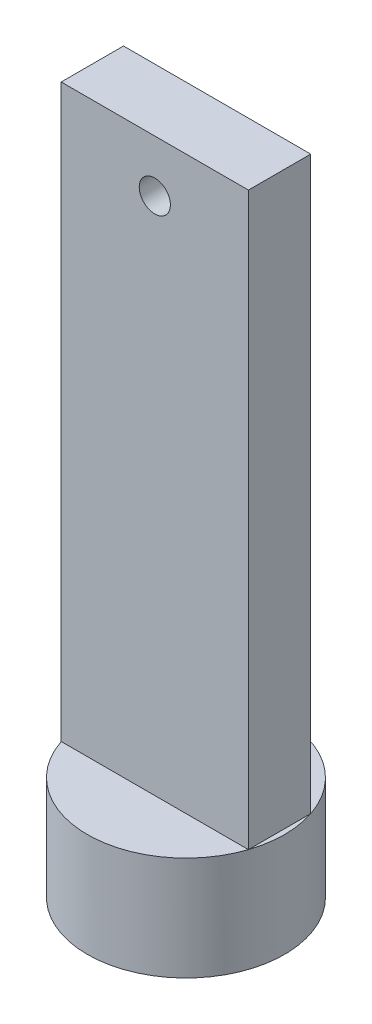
SolidWorks part; units mm, degrees
ref_plane "Front Plane" through (0, 0, 0) normal (0, 0, 1) x (1, 0, 0)
ref_plane "Top Plane" through (0, 0, 0) normal (0, 1, 0) x (1, 0, 0)
ref_plane "Right Plane" through (0, 0, 0) normal (1, 0, 0) x (0, 0, -1)
sketch "Sketch1" plane through (0, 0, 0) normal (0, 1, 0) x (1, 0, 0)
  circle A0 centre (0, 0) radius 475
  circle A1 centre (0, 0) radius 45.5135
  dimension "D1" = 950
extrude "Boss-Extrude1" add sketch "Sketch1" along normal blind 500
sketch "Sketch2" plane through (0, 500, 0) normal (0, 1, 0) x (1, 0, 0)
  line L0 (0, 150) -> (0, -150) construction
  line L1 (-450.6939, 150) -> (450.6939, 150)
  line L2 (-450.6939, 150) -> (-450.6939, -150)
  line L3 (-450.6939, -150) -> (450.6939, -150)
  line L4 (450.6939, 150) -> (450.6939, -150)
  circle A0 centre (0, 0) radius 475 construction
  dimension "D1" = 300
extrude "Boss-Extrude2" add sketch "Sketch2" along normal blind 2750
sketch "Sketch3" plane through (0, 0, 0) normal (0, 0, 1) x (1, 0, 0)
  circle A0 centre (0, 3000) radius 75
  dimension "D1" = 3000
  dimension "D2" = 150
extrude "Cut-Extrude1" cut sketch "Sketch3" against normal mid plane 3000
